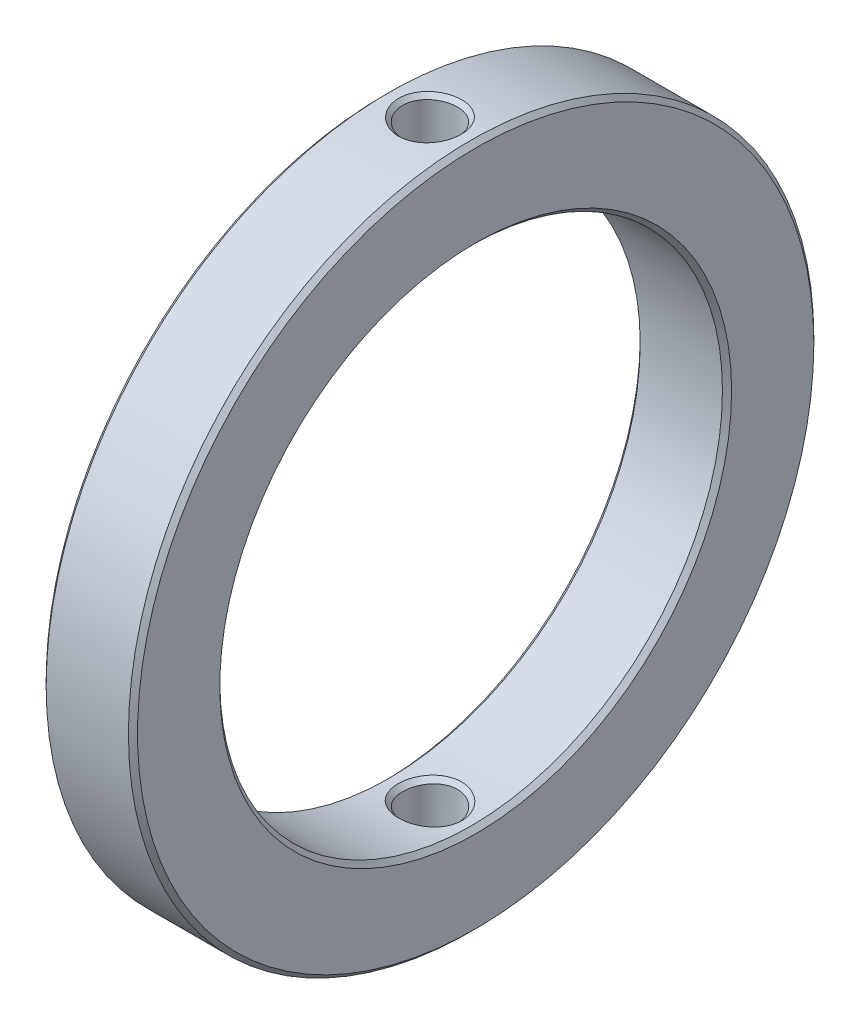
SolidWorks part; units mm, degrees
ref_plane "Спереди" through (0, 0, 0) normal (0, 0, 1) x (1, 0, 0)
ref_plane "Сверху" through (0, 0, 0) normal (0, 1, 0) x (1, 0, 0)
ref_plane "Справа" through (0, 0, 0) normal (1, 0, 0) x (0, 0, -1)
sketch "Эскиз1" plane through (0, 0, 0) normal (1, 0, 0) x (0, 0, -1)
  circle A0 centre (0, 0) radius 27.5
  circle A1 centre (0, 0) radius 37.5
  point P4 (0, -27.5)
  dimension "D1" = 55
  dimension "D2" = 75
extrude "Бобышка-Вытянуть1" add sketch "Эскиз1" along normal blind 10
sketch "Эскиз2" plane through (0, 0, 0) normal (0, 1, 0) x (1, 0, 0)
  circle A0 centre (5, 0) radius 3
  dimension "D1" = 6
  dimension "D2" = 5
extrude "Вырез-Вытянуть1" cut sketch "Эскиз2" against normal mid plane 80
chamfer "Фаска1" distance 0.5 angle 45 8 edges at (0, 0, -27.5) (10, 0, -27.5) (4.33, -27.3441, -2.9242) (5.67, 27.3441, -2.9242) (0, 0, -37.5) (10, 0, -37.5) (4.3208, -37.386, -2.9221) (5.6792, 37.386, -2.9221)
ref_plane "Плоскость1" through (0, -27.5, 0) normal (0, 1, 0) x (-1, 0, 0)
